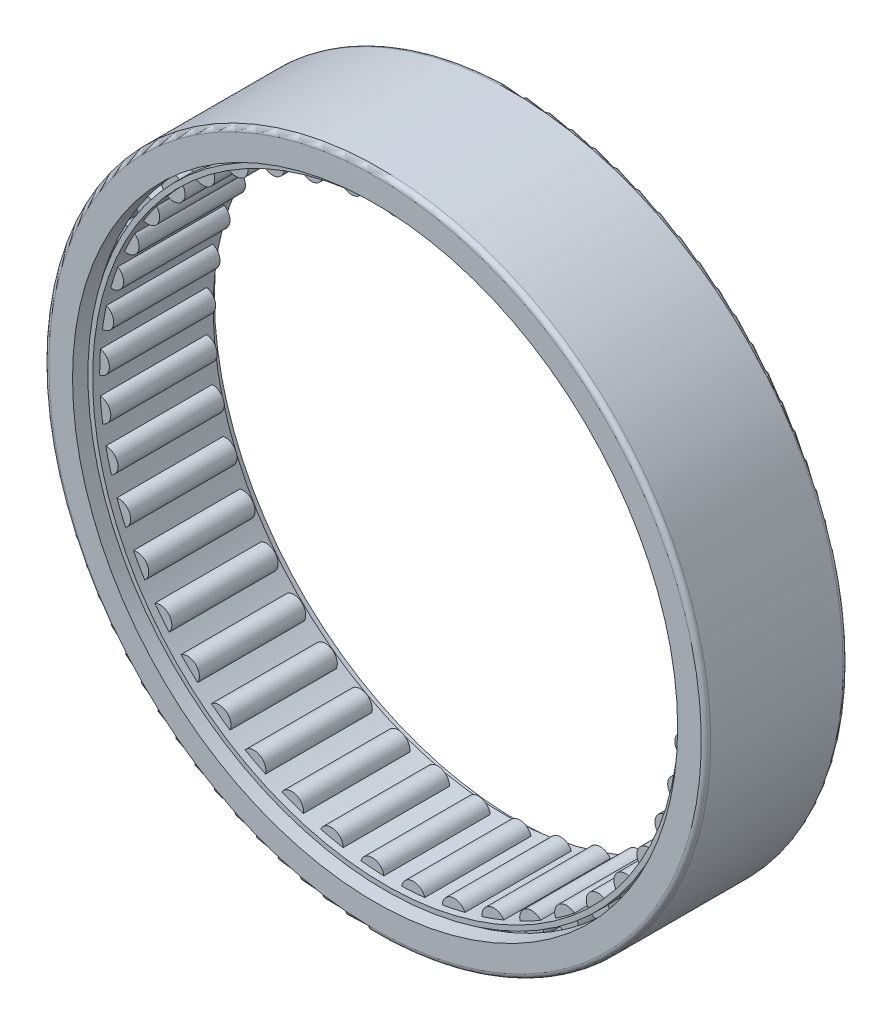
SolidWorks part; units mm, degrees
ref_plane "Front Plane" through (0, 0, 0) normal (0, 0, 1) x (1, 0, 0)
ref_plane "Top Plane" through (0, 0, 0) normal (0, 1, 0) x (1, 0, 0)
ref_plane "Right Plane" through (0, 0, 0) normal (1, 0, 0) x (0, 0, -1)
sketch "BaseSke" plane through (0, 0, 0) normal (1, 0, 0) x (0, 0, -1)
  line L0 (-47.2296, 0) -> (24.6132, 0) construction
  line L1 (-47.2296, 62.5) -> (24.6132, 62.5) construction
  line L2 (0, 129.5214) -> (0, -86.3012) construction
  line L3 (-11.25, 62.5) -> (-11.25, 65) construction
  line L4 (-15, 70) -> (15, 70) construction
  line L5 (-15, 55) -> (15, 55) construction
  line L6 (-11.25, 60) -> (11.25, 60)
  line L7 (-11.25, 60) -> (-11.25, 62.5)
  line L8 (-11.25, 62.5) -> (11.25, 62.5)
  line L9 (11.25, 60) -> (11.25, 62.5)
  line L10 (-11.25, 65) -> (11.25, 65) construction
  line L11 (11.25, 65) -> (11.25, 62.5) construction
  dimension "D2" = 22.5
  dimension "D1" = 125
  dimension "Bearing_Thickness" = 30
  dimension "Bearing_Outside_Diameter" = 140
  dimension "Bearing_Inside_Diameter" = 110
  dimension "Diameter_Fw" = 120
revolve "Roller" add sketch "BaseSke" angle 360 about L8
sketch "OuterRaceSke" plane through (0, 0, 0) normal (1, 0, 0) x (0, 0, -1)
  line L0 (0, 0) -> (0, 87.5396) construction
  line L1 (-15, 70) -> (15, 70)
  line L2 (-15, 70) -> (-15, 64)
  line L3 (-15, 64) -> (-11.275, 64)
  line L4 (15, 70) -> (15, 64)
  line L5 (-50.3916, 0) -> (55.2197, 0) construction
  line L6 (-11.25, 65) -> (11.25, 65) construction
  line L7 (11.275, 64) -> (15, 64)
  line L9 (-11.275, 64) -> (-11.275, 64.98)
  line L10 (-11.275, 64.98) -> (11.275, 64.98)
  line L11 (11.275, 64) -> (11.275, 64.98)
  dimension "D1" = 22.55
  dimension "D2" = 128
  dimension "D3" = 0.02
revolve "OuterRace" add sketch "OuterRaceSke" angle 360 about L5
sketch "CageSke" plane through (0, 0, 0) normal (1, 0, 0) x (0, 0, -1)
  line L0 (-70.8626, 0) -> (113.5527, 0) construction
  line L1 (0, 58.441) -> (0, -70.8113) construction
  line L2 (-12.75, 62) -> (12.75, 62)
  line L3 (-12.75, 62) -> (-12.75, 63)
  line L4 (-33.2996, 62.5) -> (13.017, 62.5) construction
  line L5 (-47.2296, 62.5) -> (24.6132, 62.5) construction
  line L6 (0, 129.5214) -> (0, -86.3012) construction
  line L7 (-12.75, 63) -> (12.75, 63)
  line L9 (12.75, 62) -> (12.75, 63)
  point P17 (0, 62)
  dimension "D2" = 1
  dimension "D1" = 25.5
revolve "Cage" add sketch "CageSke" angle 360 about L0
fillet "Fillet1" radius 1 2 edges at (70, 0, -15) (70, 0, 15)
pattern_circular "CirPatternBall" count 45 over 360 about axis through (0, 0, 0) along (0, 0, 1) of "Roller"
sketch "SimplifiedSke" plane through (0, 0, 0) normal (1, 0, 0) x (0, 0, -1)
  line L0 (37.5911, 0) -> (-37.5911, 0) construction
  line L1 (-13.1351, 62.5) -> (13.151, 62.5) construction
  line L2 (-11.25, 65) -> (11.25, 65)
  line L3 (-11.25, 65) -> (-11.25, 60)
  line L4 (-11.25, 60) -> (11.25, 60)
  line L5 (11.25, 65) -> (11.25, 60)
  line L6 (-47.2296, 62.5) -> (24.6132, 62.5) construction
revolve "Simplified" [suppressed] add sketch "SimplifiedSke" angle 360 about L0
equation "\"D2@BaseSke\" = \"Bearing_Thickness@BaseSke\"*0.75"
equation "\"D1@BaseSke\" =  ( \"Bearing_Outside_Diameter@BaseSke\" + \"Bearing_Inside_Diameter@BaseSke\" )  / 2"
equation "\"D1@OuterRaceSke\" = \"Bearing_Thickness@BaseSke\"*0.75+0.05"
equation "\"D2@OuterRaceSke\" =\"Bearing_Outside_Diameter@BaseSke\" -  ( \"Bearing_Outside_Diameter@BaseSke\" - \"Bearing_Inside_Diameter@BaseSke\"  )/ 2.5 "
equation "\"D1@CageSke\" = \"Bearing_Thickness@BaseSke\"*0.75+3"
equation "\"D2@CageSke\" = ( \"Bearing_Outside_Diameter@BaseSke\" - \"Diameter_Fw@BaseSke\" ) *0.05"
equation "\"D1@CirPatternBall\" =  int(  ( \"Bearing_Outside_Diameter@BaseSke\" + \"Bearing_Inside_Diameter@BaseSke\" )  / 2 *  pi  /  ( \"Bearing_Outside_Diameter@BaseSke\" - \"Bearing_Inside_Diameter@BaseSke\" ) * 3.5 "
